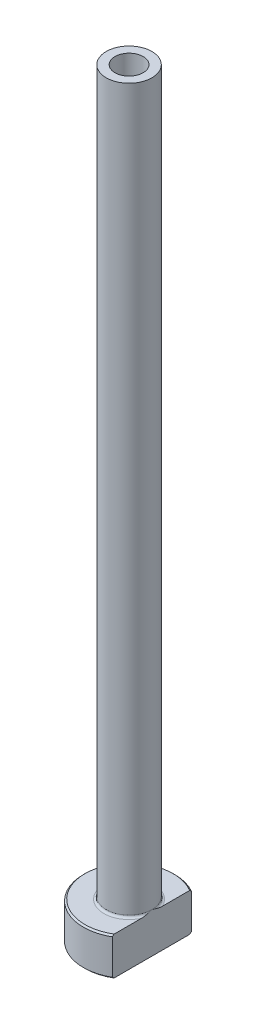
SolidWorks part; units mm, degrees
ref_plane "Front Plane" through (0, 0, 0) normal (0, 0, 1) x (1, 0, 0)
ref_plane "Top Plane" through (0, 0, 0) normal (0, 1, 0) x (1, 0, 0)
ref_plane "Right Plane" through (0, 0, 0) normal (1, 0, 0) x (0, 0, -1)
sketch "Sketch1" plane through (0, 0, 0) normal (0, 0, 1) x (1, 0, 0)
  line L0 (-1.85, 100) -> (-3, 100)
  line L1 (-3, 100) -> (-3, 5)
  line L2 (-3, 5) -> (-6, 5)
  line L3 (-6, 5) -> (-6, 0)
  line L4 (4.95, 0) -> (-4.95, 0) construction
  line L5 (-6, 0) -> (-2.1, 0)
  line L6 (-1.85, 55) -> (-1.85, 100)
  line L7 (0, 92.1877) -> (0, -15.5353) construction
  line L8 (0, -6.6) -> (0, 6.6) construction
  line L9 (-1.85, 55) -> (-2.1, 43)
  line L10 (-2.1, 43) -> (-2.1, 0)
  dimension "D1" = 0.25
  dimension "ID" = 3.7
  dimension "OD" = 6
  dimension "L" = 100
  dimension "H" = 12
  dimension "T" = 5
  dimension "N" = 45
  dimension "D2" = 12
  dimension "L-N" = 55
revolve "Revolve1" add sketch "Sketch1" angle 360 about L7
fillet "Fillet1" radius 0.3 1 edges at (0, 5, 3)
chamfer "Chamfer1" distance 0.2 angle 45 2 edges at (0, 5, 6) (0, 0, 6)
sketch "Sketch2" plane through (0, 0, 0) normal (0, -1, 0) x (1, 0, 0)
  line L0 (3, 5.1962) -> (3, -5.1962)
  circle A0 centre (0, 0) radius 6 construction
  arc A1 (3, 5.1962) -> (3, -5.1962) centre (0, 0) cw
  circle A2 centre (0, 0) radius 3 construction
extrude "Cut-Extrude1" cut sketch "Sketch2" against normal through all
chamfer "Chamfer2" distance 0.5 angle 45 1 edges at (0, 0, 2.1)
